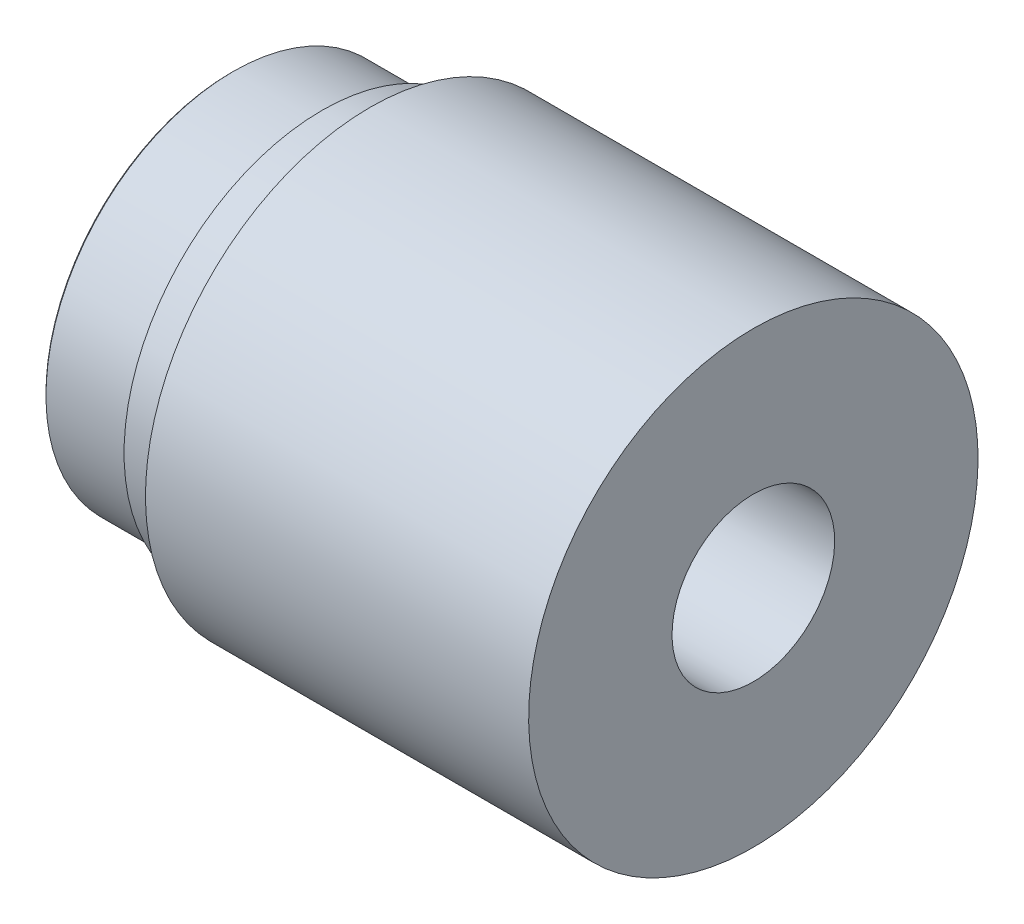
SolidWorks part; units mm, degrees
ref_plane "Plan de face" through (0, 0, 0) normal (0, 0, 1) x (1, 0, 0)
ref_plane "Plan de dessus" through (0, 0, 0) normal (0, 1, 0) x (1, 0, 0)
ref_plane "Plan de droite" through (0, 0, 0) normal (1, 0, 0) x (0, 0, -1)
sketch "Esquisse1" plane through (0, 0, 0) normal (0, 0, 1) x (1, 0, 0)
  line L0 (-58.16, 89.1232) -> (-58.16, 106.4232)
  line L3 (-58.16, 72.6232) -> (-58.16, 105.6232) construction
  line L5 (-58.16, 106.4232) -> (-57.96, 106.6232)
  line L6 (-57.96, 106.6232) -> (-57.96, 71.6232) construction
  line L7 (-57.96, 106.6232) -> (-49.66, 106.6232)
  line L8 (-49.66, 71.6232) -> (-49.66, 106.6232) construction
  line L9 (-49.66, 106.6232) -> (-49.66, 107.6232)
  line L11 (-49.66, 107.6232) -> (-45.16, 107.6232)
  line L12 (-45.16, 70.6232) -> (-45.16, 107.6232) construction
  line L13 (-45.16, 107.6232) -> (-45.16, 110.1232)
  line L15 (-45.16, 110.1232) -> (-9.3494, 110.1232)
  line L16 (-9.3494, 110.1232) -> (-9.3494, 89.1232)
  line L17 (-9.3494, 89.1232) -> (-58.16, 89.1232)
revolve "Révolution1" add sketch "Esquisse1" angle 360 about L17
sketch "Esquisse2" plane through (-9.3494, 0, 0) normal (1, 0, 0) x (0, 0, -1)
  circle A0 centre (0, 89.1232) radius 7.6
  circle A1 centre (0, 89.1232) radius 21 construction
  dimension "D1" = 15.2
extrude "Enlèv. mat.-Extru.1" cut sketch "Esquisse2" against normal through all
